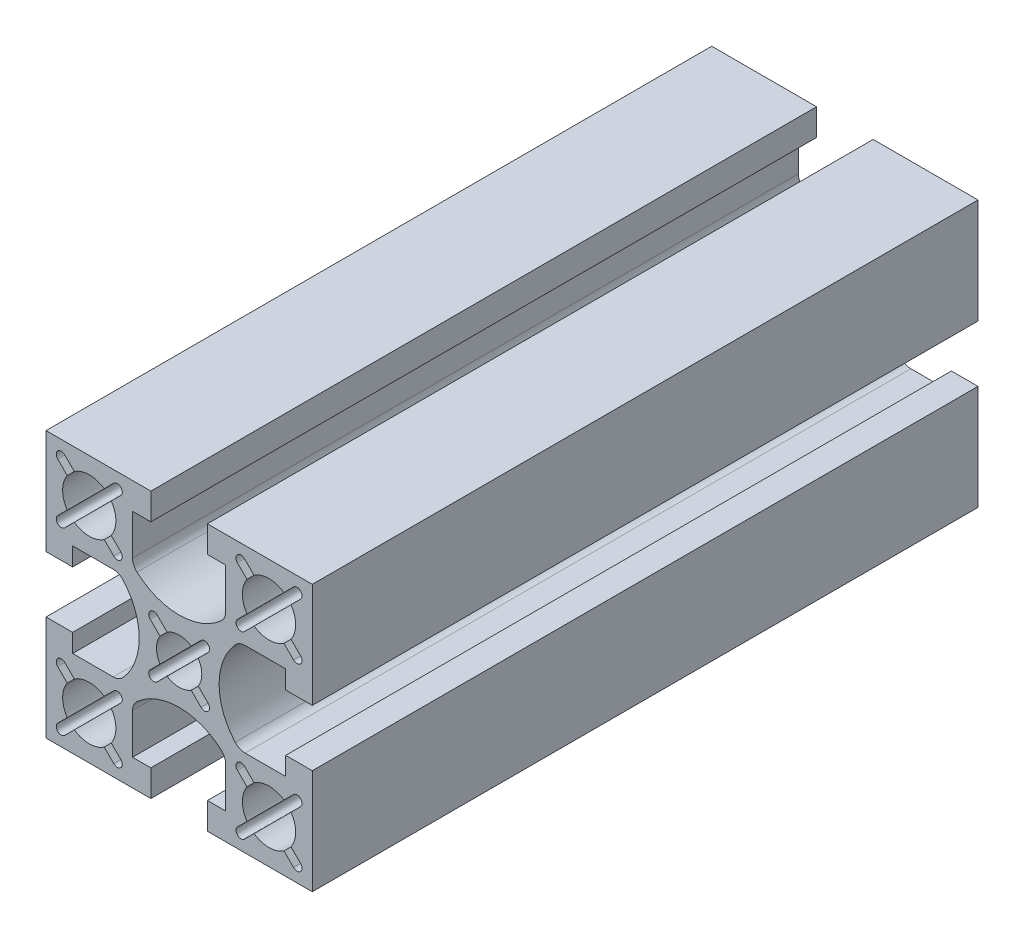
SolidWorks part; units mm, degrees
ref_plane "前基準面" through (0, 0, 0) normal (0, 0, 1) x (1, 0, 0)
ref_plane "上基準面" through (0, 0, 0) normal (0, 1, 0) x (1, 0, 0)
ref_plane "右基準面" through (0, 0, 0) normal (1, 0, 0) x (0, 0, -1)
sketch "草圖1" plane through (0, 0, 0) normal (0, 0, 1) x (1, 0, 0)
  line L0 (0, 53.2301) -> (0, -51.0629) construction
  line L2 (-20, 20) -> (20, 20)
  line L3 (-20, 20) -> (-20, -20)
  line L4 (-20, -20) -> (20, -20)
  line L5 (20, 20) -> (20, -20)
  line L6 (-20, 20) -> (20, -20) construction
  line L7 (-20, -20) -> (20, 20) construction
  point P3 (0, 0)
  dimension "D1" = 40
  dimension "D2" = 40
extrude "填料-伸長1" add sketch "草圖1" along normal mid plane 100
sketch "草圖2" plane through (0, 0, 50) normal (0, 0, 1) x (1, 0, 0)
  circle A0 centre (0, 0) radius 3.4
  dimension "D1" = 6.8
extrude "除料-伸長1" cut sketch "草圖2" against normal through all
sketch "草圖3" plane through (0, 0, 50) normal (0, 0, 1) x (1, 0, 0)
  circle A0 centre (-13.5, 13.5) radius 4
  circle A1 centre (0, 0) radius 3.4 construction
  dimension "D2" = 8
  dimension "D1" = 13.5
  dimension "D3" = 13.5
extrude "除料-伸長2" cut sketch "草圖3" against normal through all
pattern_circular "環狀複製排列1" count 4 over 360 about axis through (0, 0, 0) along (0, 0, 1) of "除料-伸長2"
sketch "草圖4" plane through (0, 0, 50) normal (0, 0, 1) x (1, 0, 0)
  line L0 (4.25, 20) -> (-4.25, 20)
  line L1 (20, 20) -> (-20, 20) construction
  line L2 (-4.25, 20) -> (-4.25, 16)
  line L3 (-4.25, 16) -> (-7, 16)
  line L4 (-7, 16) -> (-7, 9.9098)
  line L5 (0, 0) -> (0, 20) construction
  line L6 (7, 16) -> (7, 9.9098)
  line L7 (4.25, 16) -> (7, 16)
  line L8 (4.25, 20) -> (4.25, 16)
  arc A0 (-6.3333, 8.4191) -> (6.3333, 8.4191) centre (0, 15.5) ccw
  arc A1 (7, 9.9098) -> (6.3333, 8.4191) centre (5, 9.9098) cw
  arc A2 (-7, 9.9098) -> (-6.3333, 8.4191) centre (-5, 9.9098) ccw
  point P16 (7, 9.0774)
  point P19 (-7, 9.0774)
  dimension "D1" = 9.5
  dimension "D6" = 2
  dimension "D2" = 4
  dimension "D3" = 4.5
  dimension "D4" = 14
  dimension "D5" = 8.5
extrude "除料-伸長3" cut sketch "草圖4" against normal through all
pattern_circular "環狀複製排列2" count 4 over 360 about axis through (0, 0, 0) along (0, 0, 1) of "除料-伸長3"
sketch "草圖5" plane through (0, 0, 50) normal (0, 0, 1) x (1, 0, 0)
  line L0 (-13.5, 13.5) -> (-20, 20) construction
  line L1 (-15.7479, 16.8086) -> (-17.179, 18.2397)
  line L2 (-16.8086, 15.7479) -> (-18.2397, 17.179)
  line L3 (-12.9697, 14.0303) -> (-19.4697, 20.5303) construction
  line L4 (-14.0303, 12.9697) -> (-20.5303, 19.4697) construction
  circle A1 centre (-13.5, 13.5) radius 4 construction
  circle A2 centre (-13.5, 13.5) radius 6
  arc A3 (-17.179, 18.2397) -> (-18.2397, 17.179) centre (-13.5, 13.5) ccw construction
  arc A4 (-15.7479, 16.8086) -> (-16.8086, 15.7479) centre (-13.5, 13.5) ccw
  arc A5 (-17.179, 18.2397) -> (-18.2397, 17.179) centre (-17.7094, 17.7094) ccw
  dimension "D1" = 0.75
  dimension "D2" = 0.75
  dimension "D3" = 2
extrude "除料-伸長4" cut sketch "草圖5" against normal through all
pattern_circular "環狀複製排列3" count 4 over 360 about axis through (-13.5, 13.5, 0) along (0, 0, 1) of "除料-伸長4"
pattern_circular "環狀複製排列4" count 4 over 360 about axis through (0, 0, 0) along (0, 0, 1) of "除料-伸長4", "環狀複製排列3"
sketch "草圖6" plane through (0, 0, 50) normal (0, 0, 1) x (1, 0, 0)
  line L0 (-13.5, 13.5) -> (0, 0) construction
  line L1 (-4.3487, 3.288) -> (-2.8753, 1.8146)
  line L2 (-3.288, 4.3487) -> (-1.8146, 2.8753)
  line L3 (-14.0303, 12.9697) -> (-0.5303, -0.5303) construction
  line L4 (-12.9697, 14.0303) -> (0.5303, 0.5303) construction
  arc A5 (-3.288, 4.3487) -> (-4.3487, 3.288) centre (-3.8184, 3.8184) ccw
  circle A7 centre (0, 0) radius 3.4 construction
  arc A8 (-1.8146, 2.8753) -> (-2.8753, 1.8146) centre (0, 0) ccw
  dimension "D2" = 0.75
  dimension "D4" = 5.4
  dimension "D3" = 0.75
extrude "除料-伸長5" cut sketch "草圖6" against normal through all
pattern_circular "環狀複製排列5" count 4 over 360 about axis through (0, 0, 0) along (0, 0, 1) of "除料-伸長5"
